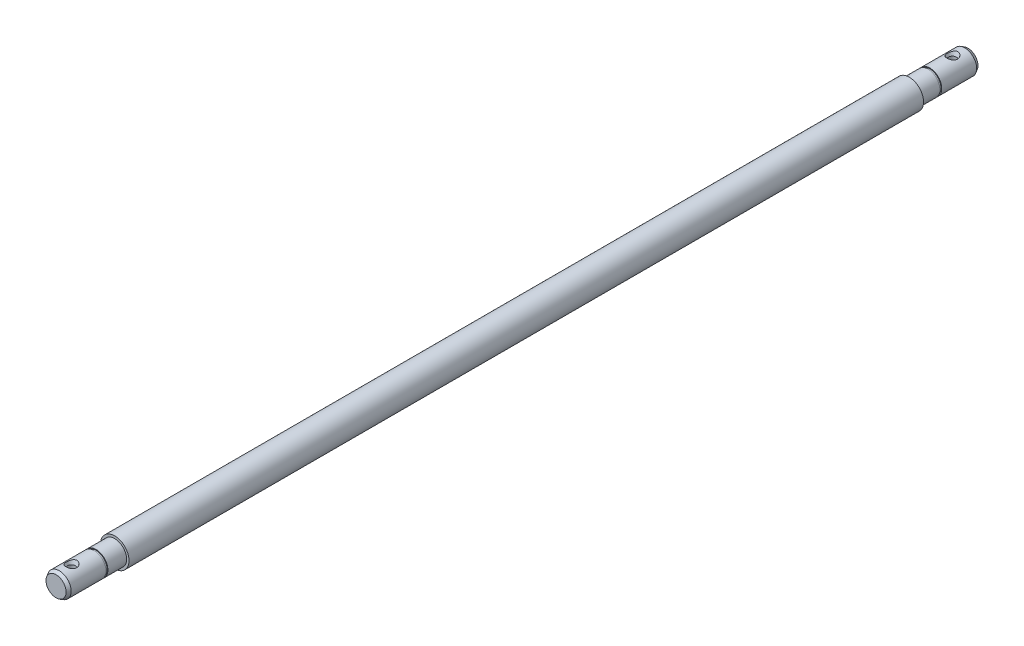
SolidWorks part; units mm, degrees
ref_plane "Plan de face" through (0, 0, 0) normal (0, 0, 1) x (1, 0, 0)
ref_plane "Plan de dessus" through (0, 0, 0) normal (0, 1, 0) x (1, 0, 0)
ref_plane "Plan de droite" through (0, 0, 0) normal (1, 0, 0) x (0, 0, -1)
sketch "Esquisse1" plane through (0, 0, 0) normal (0, 0, 1) x (1, 0, 0)
  circle A0 centre (0, 0) radius 7.5
  dimension "D1" = 15
extrude "Extrusion1" add sketch "Esquisse1" along normal blind 287.5
ref_plane "Plan2" through (0, 0, 37) normal (0, 0, -1) x (-1, 0, 0)
ref_plane "Plan1" through (0, 7.5, 0) normal (0, 1, 0) x (-1, 0, 0)
chamfer "Chanfrein1" distance 2 angle 30 1 edges at (7.5, 0, 0)
hole_wizard "Trou taraudé M61" positions "Esquisse3" profile "Esquisse2" tap size "M6" standard "ISO"
sketch "Esquisse3" plane through (-8.2491, 7.5, -28.8697) normal (0, 1, 0) x (1, 0, 0)
  line L0 (8.2491, -28.8697) -> (8.2491, -38.1075) construction
  line L2 (0.7491, -316.3697) -> (15.7491, -316.3697) construction
  point P0 (8.2491, -38.6197)
  dimension "D1" = 277.75
sketch "Esquisse2" plane through (0, 7.5, 9.75) normal (1, 0, 0) x (0, 0, 1)
  line L0 (0, 0) -> (0, 15)
  line L1 (0, 15) -> (3.5, 15)
  line L2 (2.5, 12.5858) -> (2.5, 2.4142)
  line L3 (2.5, 2.4142) -> (3.5, 0)
  line L5 (3.5, 0) -> (0, 0)
  line L6 (-2.5, 2.4142) -> (-3.5, 0) construction
  line L7 (3.5, 15) -> (2.5, 12.5858)
  line L8 (-3.5, 15) -> (-2.5, 12.5858) construction
  line L11 (0, -6.35) -> (0, 107.95) construction
  dimension "Diamètre du trou pour taraudage jusqu'au prochain" = 5
  dimension "Profondeur du trou pour taraudage jusqu'au prochain" = 15
  dimension "Diamètre du fraisage entrant" = 7
  dimension "Angle du fraisage entrant" = 45
  dimension "Diamètre du fraisage débouchant" = 7
  dimension "Angle du fraisage débouchant" = 45
sketch "Esquisse4" plane through (0, 0, 0) normal (0, 1, 0) x (1, 0, 0)
  line L0 (7.5, -287.5) -> (7.5, -2) construction
  line L1 (7.5, -24) -> (7, -24)
  line L2 (7.5, -24) -> (7.5, -25.2)
  line L3 (7.5, -25.2) -> (7, -25.2)
  line L4 (7, -24) -> (7, -25.2)
  line L5 (0, 0) -> (0, -24.5329) construction
  line L6 (6.3453, 0) -> (-6.3453, 0) construction
  dimension "D1" = 24
  dimension "D2" = 1.2
  dimension "D3" = 0.5
revolve "Enlèvement de matière-Révolution1" cut sketch "Esquisse4" angle 360 about L5
sketch "Esquisse5" plane through (0, 0, 287.5) normal (0, 0, 1) x (1, 0, 0)
  circle A2 centre (0, 0) radius 9
  circle A3 centre (0, 0) radius 9
  dimension "D1" = 1.5
extrude "Extrusion2" add sketch "Esquisse5" against normal up to surface (250.5 mm away)
ref_plane "Plan médian" through (0, 0, 287.5) normal (0, 0, 1) x (1, 0, 0)
mirror "Symétrie3" about plane through (0, 0, 287.5) normal (0, 0, 1) of "Extrusion2", "Enlèvement de matière-Révolution1", "Trou taraudé M61", "Chanfrein1", "Extrusion1"
ref_point "Point1"
